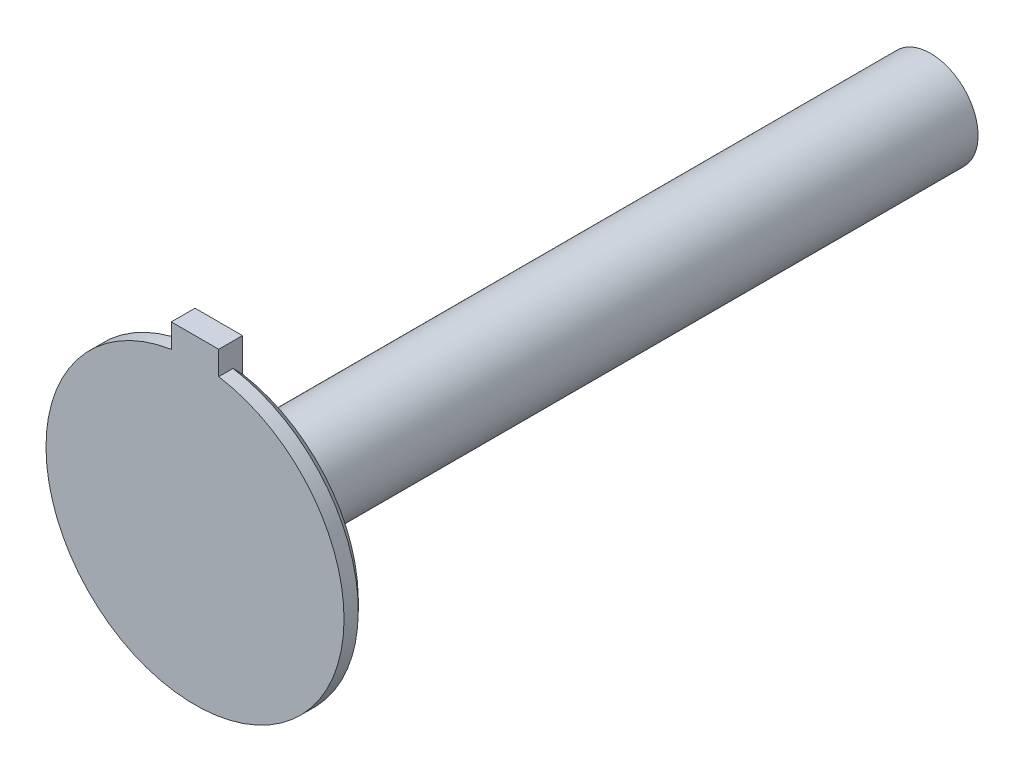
SolidWorks part; units mm, degrees
ref_plane "Plan1" through (0, 0, 0) normal (0, 0, 1) x (1, 0, 0)
ref_plane "Plan2" through (0, 0, 0) normal (0, 1, 0) x (1, 0, 0)
ref_plane "Plan3" through (0, 0, 0) normal (1, 0, 0) x (0, 0, -1)
sketch "Esquisse1" plane through (0, 0, 0) normal (0, 0, 1) x (1, 0, 0)
  line L1 (-5, 30.9994) -> (-5, 35.9994)
  line L2 (-5, 35.9994) -> (5, 35.9994)
  line L3 (5, 35.9994) -> (5, 30.9994)
  line L4 (5, 30.9994) -> (5, 33.0236) construction
  arc A0 (-5, 30.9994) -> (5, 30.9994) centre (0, 0) ccw
  arc A1 (5, -30.9994) -> (5, 30.9994) centre (0, 0) ccw construction
  dimension "D1" = 5
extrude "Base-Extrusion" add sketch "Esquisse1" along normal up to surface (5 mm away)
sketch "Esquisse2" plane through (0, 0, 0) normal (0, 0, -1) x (-1, 0, 0)
  circle A0 centre (0, 0) radius 10
  dimension "D1" = 20
extrude "Boss.-Extru.1" add sketch "Esquisse2" along normal blind 150
chamfer "Chanfrein1" distance 2 angle 45
